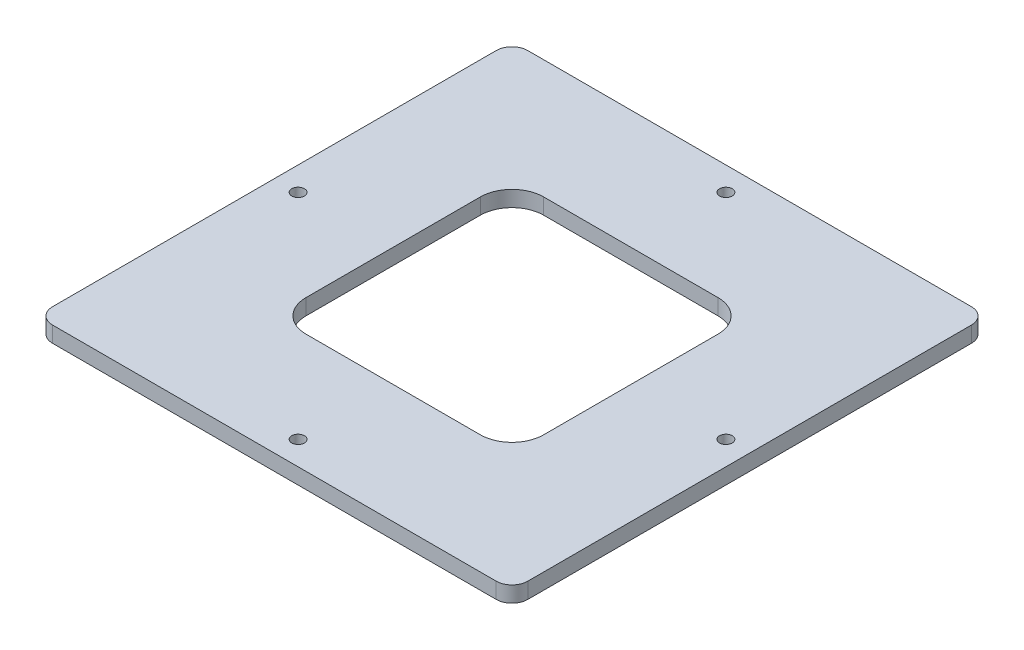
SolidWorks part; units mm, degrees
ref_plane "Ebene vorne" through (0, 0, 0) normal (0, 0, 1) x (1, 0, 0)
ref_plane "Ebene oben" through (0, 0, 0) normal (0, 1, 0) x (1, 0, 0)
ref_plane "Ebene rechts" through (0, 0, 0) normal (1, 0, 0) x (0, 0, -1)
sketch "Skizze1" plane through (0, 0, 0) normal (0, 1, 0) x (1, 0, 0)
  line L0 (0, 69.068) -> (0, -69.9367) construction
  line L1 (-56, 60) -> (56, 60)
  line L2 (-60, 56) -> (-60, -56)
  line L3 (-56, -60) -> (56, -60)
  line L4 (60, 56) -> (60, -56)
  line L5 (-63.2683, 0) -> (64.2442, 0) construction
  line L6 (60, 40) -> (40, 40) construction
  line L7 (40, 60) -> (40, 40) construction
  line L8 (-60, -40) -> (-40, -40) construction
  line L9 (-40, -60) -> (-40, -40) construction
  line L10 (40, -60) -> (40, -40) construction
  line L11 (60, -40) -> (40, -40) construction
  line L39 (-22, 30) -> (22, 30)
  line L40 (-30, 22) -> (-30, -22)
  line L41 (-22, -30) -> (22, -30)
  line L42 (30, 22) -> (30, -22)
  line L45 (-60, 40) -> (-40, 40) construction
  line L46 (-40, 60) -> (-40, 40) construction
  arc A0 (-22, -30) -> (-30, -22) centre (-22, -22) cw
  arc A1 (22, -30) -> (30, -22) centre (22, -22) ccw
  arc A2 (30, 22) -> (22, 30) centre (22, 22) ccw
  arc A3 (-60, -56) -> (-56, -60) centre (-56, -56) ccw
  arc A4 (60, -56) -> (56, -60) centre (56, -56) cw
  arc A5 (56, 60) -> (60, 56) centre (56, 56) cw
  arc A6 (-56, 60) -> (-60, 56) centre (-56, 56) ccw
  arc A7 (-22, 30) -> (-30, 22) centre (-22, 22) ccw
  circle A8 centre (0, 54) radius 1.6
  circle A9 centre (54, 0) radius 1.6
  circle A10 centre (0, -54) radius 1.6
  circle A11 centre (-54, 0) radius 1.6
  point P25 (-60, -60)
  point P26 (-30, -30)
  point P33 (30, 30)
  point P37 (-30, 30)
  point P50 (0, 0)
  point P55 (60, 60)
  point P58 (-60, 60)
  point P59 (0, 0)
  dimension "D3" = 60
  dimension "D4" = 60
  dimension "D11" = 4
  dimension "D7" = 8
  dimension "D9" = 3.2
  dimension "D1" = 120
  dimension "D2" = 120
  dimension "D5" = 20
  dimension "D6" = 20
  dimension "D8" = 6
  dimension "D10" = 4
extrude "Aufsatz-Linear austragen1" add sketch "Skizze1" along normal blind 4
